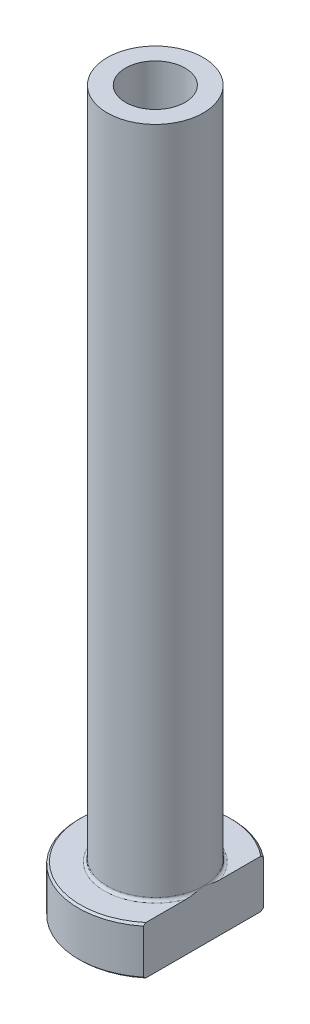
SolidWorks part; units mm, degrees
ref_plane "Front Plane" through (0, 0, 0) normal (0, 0, 1) x (1, 0, 0)
ref_plane "Top Plane" through (0, 0, 0) normal (0, 1, 0) x (1, 0, 0)
ref_plane "Right Plane" through (0, 0, 0) normal (1, 0, 0) x (0, 0, -1)
sketch "Sketch1" plane through (0, 0, 0) normal (0, 0, 1) x (1, 0, 0)
  line L0 (-3.1, 75) -> (-5, 75)
  line L1 (-5, 75) -> (-5, 5)
  line L2 (-5, 5) -> (-8, 5)
  line L3 (-8, 5) -> (-8, 0)
  line L4 (7.15, 0) -> (-7.15, 0) construction
  line L5 (-8, 0) -> (-3.35, 0)
  line L6 (-3.1, 30) -> (-3.1, 75)
  line L7 (0, 92.1877) -> (0, -15.5353) construction
  line L8 (0, -8.8) -> (0, 8.8) construction
  line L9 (-3.1, 30) -> (-3.35, 18)
  line L10 (-3.35, 18) -> (-3.35, 0)
  dimension "D1" = 0.25
  dimension "ID" = 6.2
  dimension "OD" = 10
  dimension "L" = 75
  dimension "H" = 16
  dimension "T" = 5
  dimension "N" = 45
  dimension "D2" = 12
  dimension "L-N" = 30
revolve "Revolve1" add sketch "Sketch1" angle 360 about L7
fillet "Fillet1" radius 0.3 1 edges at (0, 5, 5)
chamfer "Chamfer1" distance 0.2 angle 45 2 edges at (0, 5, 8) (0, 0, 8)
sketch "Sketch2" plane through (0, 0, 0) normal (0, -1, 0) x (1, 0, 0)
  line L0 (5, 6.245) -> (5, -6.245)
  circle A0 centre (0, 0) radius 8 construction
  arc A1 (5, 6.245) -> (5, -6.245) centre (0, 0) cw
  circle A2 centre (0, 0) radius 5 construction
extrude "Cut-Extrude1" cut sketch "Sketch2" against normal through all
chamfer "Chamfer2" distance 0.5 angle 45 1 edges at (0, 0, 3.35)
